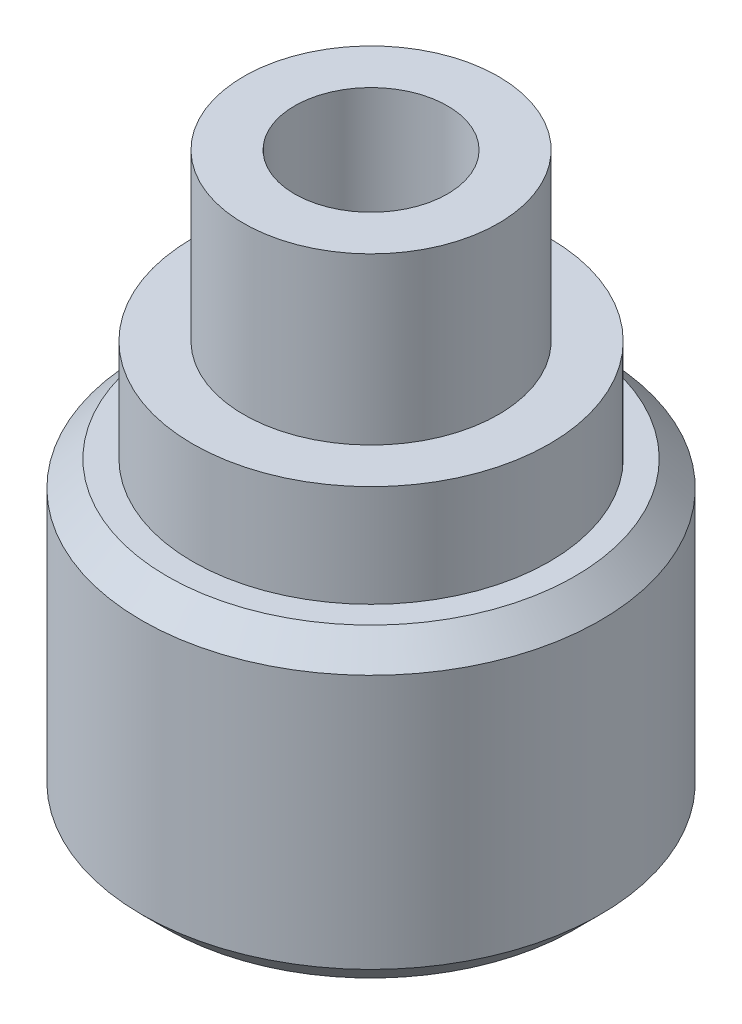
SolidWorks part; units mm, degrees
ref_plane "Front Plane" through (0, 0, 0) normal (0, 0, 1) x (1, 0, 0)
ref_plane "Top Plane" through (0, 0, 0) normal (0, 1, 0) x (1, 0, 0)
ref_plane "Right Plane" through (0, 0, 0) normal (1, 0, 0) x (0, 0, -1)
sketch "Sketch1" plane through (0, 0, 0) normal (0, 1, 0) x (1, 0, 0)
  circle A0 centre (0, 0) radius 9
  dimension "D1" = 18
extrude "Extrude1" add sketch "Sketch1" along normal blind 12
sketch "Sketch2" plane through (0, 12, 0) normal (0, 1, 0) x (1, 0, 0)
  circle A0 centre (0, 0) radius 7
  dimension "D1" = 14
extrude "Extrude2" add sketch "Sketch2" along normal blind 4
sketch "Sketch3" plane through (0, 16, 0) normal (0, 1, 0) x (1, 0, 0)
  circle A0 centre (0, 0) radius 5
  dimension "D1" = 10
extrude "Extrude3" add sketch "Sketch3" along normal blind 6.5
hole_wizard "M6 Tapped Hole1" positions "3DSketch1" profile "Sketch5" tap size "M6" standard "ISO"
sketch3d "3DSketch1"
  line L0 (0, 22.5, 0) -> (0, 16, 0) construction
  point P0 (0, 22.5, 0)
sketch "Sketch5" plane through (0, 22.5, 0) normal (1, 0, 0) x (0, 0, 1)
  line L0 (0, 0) -> (0, 22.5)
  line L1 (0, 22.5) -> (2.5, 22.5)
  line L3 (2.5, 22.5) -> (2.5, 11.5)
  line L4 (2.5, 11.5) -> (3, 11.5)
  line L5 (3, 11.5) -> (3, 0)
  line L7 (3, 0) -> (0, 0)
  line L11 (0, -6.35) -> (0, 107.95) construction
  dimension "Thru Tap Drill Dia." = 5
  dimension "Thru Tap Drill Depth" = 22.5
  dimension "Thread Major Dia." = 6
  dimension "Thread Depth" = 11.5
chamfer "Chamfer1" distance 1 angle 45 2 edges at (0, 0, 9) (0, 12, 9)
